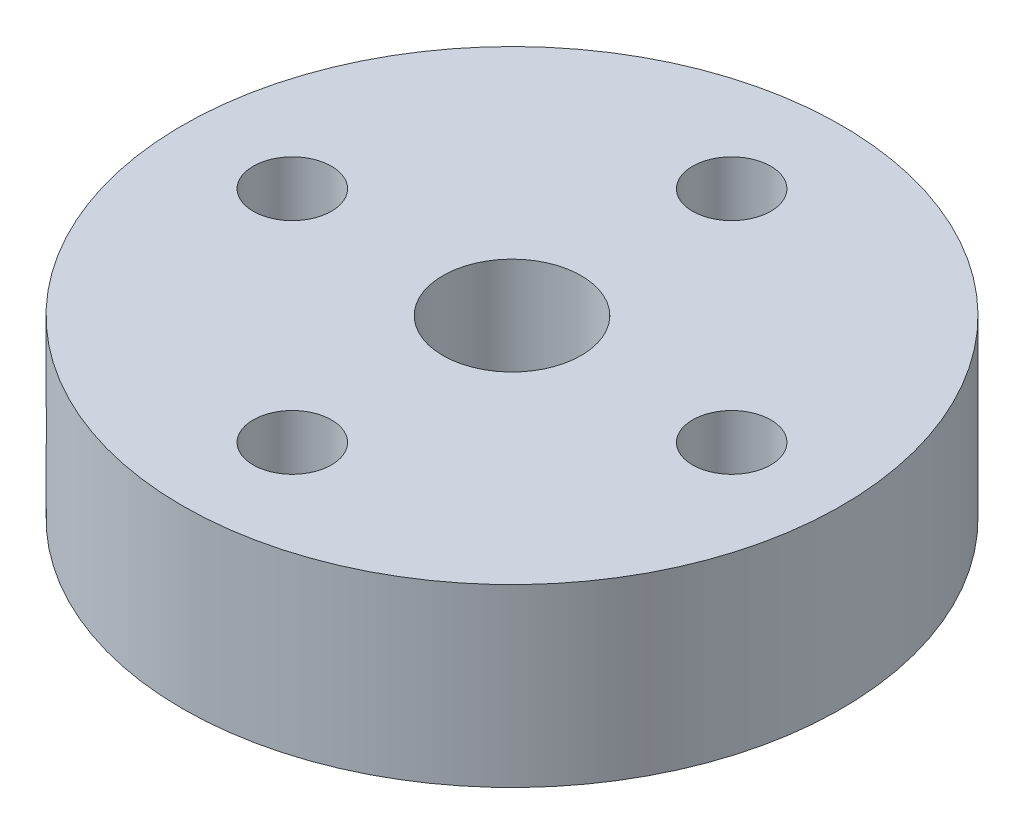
SolidWorks part; units mm, degrees
ref_plane "Plan de face" through (0, 0, 0) normal (0, 0, 1) x (1, 0, 0)
ref_plane "Plan de dessus" through (0, 0, 0) normal (0, 1, 0) x (1, 0, 0)
ref_plane "Plan de droite" through (0, 0, 0) normal (1, 0, 0) x (0, 0, -1)
sketch "Esquisse1" plane through (0, 0, 0) normal (0, 1, 0) x (1, 0, 0)
  circle A0 centre (0, 0) radius 9.525
  circle A1 centre (0, 0) radius 2
  dimension "D1" = 19.05
  dimension "D2" = 4
extrude "Boss.-Extru.1" add sketch "Esquisse1" along normal blind 5.08
hole_wizard "Trou taraudé #4-401" positions "Esquisse2" profile "Esquisse3" tap size "#4-40" standard "Ansi Inch"
sketch "Esquisse2" plane through (0, 5.08, 0) normal (0, 1, 0) x (1, 0, 0)
  point P0 (0, -6.35)
  point P2 (0, 6.35)
  point P4 (-6.35, 0)
  point P6 (6.35, 0)
  point P14 (-11.4688, 7.3033)
  point P17 (0, 0)
  dimension "D1" = 6.35
  dimension "D2" = 6.35
  dimension "D3" = 6.35
  dimension "D4" = 6.35
  dimension "D5" = 90
  dimension "D6" = 90
  dimension "D7" = 90
sketch "Esquisse3" plane through (0, 5.08, 6.35) normal (1, 0, 0) x (0, 0, 1)
  line L0 (0, 0) -> (0, 5.08)
  line L1 (0, 5.08) -> (1.1303, 5.08)
  line L2 (1.1303, 5.08) -> (1.1303, 0)
  line L5 (1.1303, 0) -> (0, 0)
  line L11 (0, -6.35) -> (0, 107.95) construction
  dimension "Diamètre du trou pour taraudage jusqu'au prochain" = 2.2606
  dimension "Profondeur du trou pour taraudage jusqu'au prochain" = 5.08
hole_wizard "Trou taraudé #4-402" positions "Esquisse3D2" profile "Esquisse4" tap size "#4-40" standard "Ansi Inch"
sketch3d "Esquisse3D2"
  point P0 (-7.2278, 2.54, 6.2036)
  dimension "D1" = 2.54
sketch "Esquisse4" plane through (-7.2278, 2.54, 6.2036) normal (0, 1, 0) x (0.6513, 0, 0.7588)
  line L0 (0, 0) -> (0, 7.525)
  line L1 (0, 7.525) -> (1.1303, 7.525)
  line L2 (1.1303, 7.525) -> (1.1303, 0)
  line L5 (1.1303, 0) -> (0, 0)
  line L11 (0, -6.35) -> (0, 107.95) construction
  dimension "Diamètre du trou pour taraudage jusqu'au prochain" = 2.2606
  dimension "Profondeur du trou pour taraudage jusqu'au prochain" = 7.525
